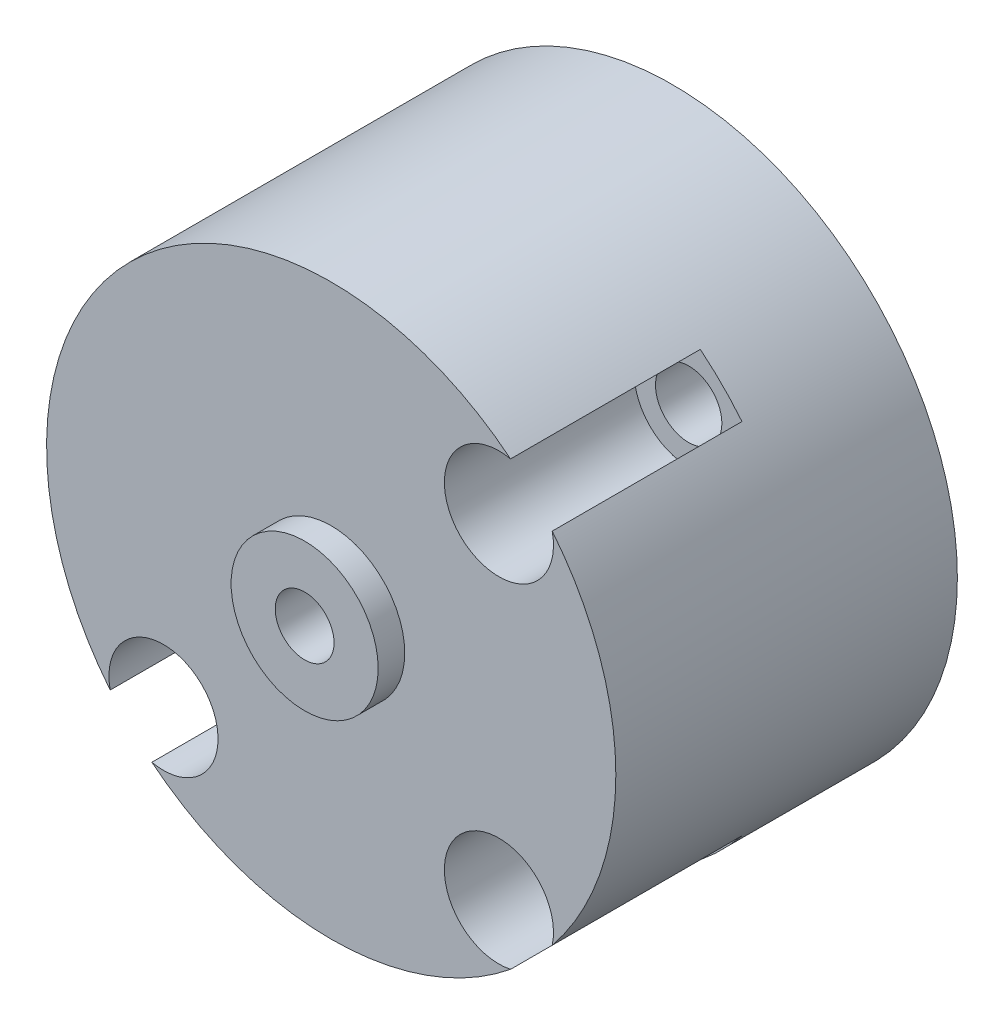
SolidWorks part; units mm, degrees
ref_plane "Alzado" through (0, 0, 0) normal (0, 0, 1) x (1, 0, 0)
ref_plane "Planta" through (0, 0, 0) normal (0, 1, 0) x (1, 0, 0)
ref_plane "Vista lateral" through (0, 0, 0) normal (1, 0, 0) x (0, 0, -1)
sketch "Croquis1" plane through (0, 0, 0) normal (0, 0, 1) x (1, 0, 0)
  circle A0 centre (0, 158.0446) radius 15
  circle A9 centre (8.8388, 149.2057) radius 1.75
  circle A10 centre (8.8388, 166.8834) radius 1.75
  circle A11 centre (-8.8388, 149.2057) radius 1.75
  circle A18 centre (0, 158.0446) radius 1.75
  dimension "D2" = 30
  dimension "D1" = 158.0446
extrude "Saliente-Extruir1" add sketch "Croquis1" along normal blind 5
sketch "Croquis2" plane through (0, 0, 5) normal (0, 0, 1) x (1, 0, 0)
  circle A0 centre (0, 158.0446) radius 15
  circle A5 centre (0, 158.0446) radius 1.55
  circle A6 centre (8.8388, 166.8834) radius 1.55
  circle A7 centre (8.8388, 149.2057) radius 1.55
  circle A8 centre (-8.8388, 149.2057) radius 1.55
extrude "Saliente-Extruir2" add sketch "Croquis2" along normal blind 13 and the other way blind 3
sketch "Croquis3" plane through (0, 0, 18) normal (0, 0, 1) x (1, 0, 0)
  circle A0 centre (0, 158.0446) radius 3.875
  circle A1 centre (0, 158.0446) radius 1.55
  dimension "D1" = 7.75
  dimension "D2" = 3.1
extrude "Saliente-Extruir3" add sketch "Croquis3" along normal blind 1.4
sketch "Croquis5" plane through (0, 0, 18) normal (0, 0, 1) x (1, 0, 0)
  circle A0 centre (8.8388, 166.8834) radius 2.875
  circle A1 centre (8.8388, 149.2057) radius 2.875
  circle A2 centre (-8.8388, 149.2057) radius 2.875
  dimension "D1" = 5.75
extrude "Cortar-Extruir1" cut sketch "Croquis5" against normal blind 10
sketch "Croquis6" plane through (0, 0, 0) normal (0, 0, -1) x (-1, 0, 0)
  arc A1 (1.0839, 159.1285) -> (-1.0839, 156.9607) centre (0, 158.0446) ccw construction
  arc A2 (1.0839, 159.1285) -> (-1.0839, 156.9607) centre (0, 158.0446) ccw construction
  circle A3 centre (0, 158.0446) radius 4
  dimension "D1" = 8
extrude "Cortar-Extruir2" cut sketch "Croquis6" against normal blind 12
sketch "Croquis7" plane through (0, 0, 12) normal (0, 0, -1) x (-1, 0, 0)
  line L1 (2.6503, 160.7015) -> (-0.9758, 161.6683)
  line L2 (-0.9758, 161.6683) -> (-3.6261, 159.0113)
  line L3 (-3.6261, 159.0113) -> (-2.6503, 155.3876)
  line L4 (-2.6503, 155.3876) -> (0.9758, 154.4209)
  line L5 (0.9758, 154.4209) -> (3.6261, 157.0778)
  line L6 (3.6261, 157.0778) -> (2.6503, 160.7015)
  circle A0 centre (0, 158.0446) radius 3.25 construction
  dimension "D1" = 6.5
extrude "Cortar-Extruir3" cut sketch "Croquis7" against normal blind 3.3
sketch "Croquis8" plane through (0, 0, 0) normal (0, 0, -1) x (-1, 0, 0)
  circle A0 centre (-8.8388, 149.2057) radius 1.75 construction
  circle A1 centre (8.8388, 149.2057) radius 1.75 construction
  circle A2 centre (-8.8388, 166.8834) radius 1.75 construction
  circle A3 centre (-8.8388, 149.2057) radius 1.75
  circle A4 centre (8.8388, 149.2057) radius 1.75
  circle A5 centre (-8.8388, 166.8834) radius 1.75
extrude "Cortar-Extruir4" cut sketch "Croquis8" against normal through all
